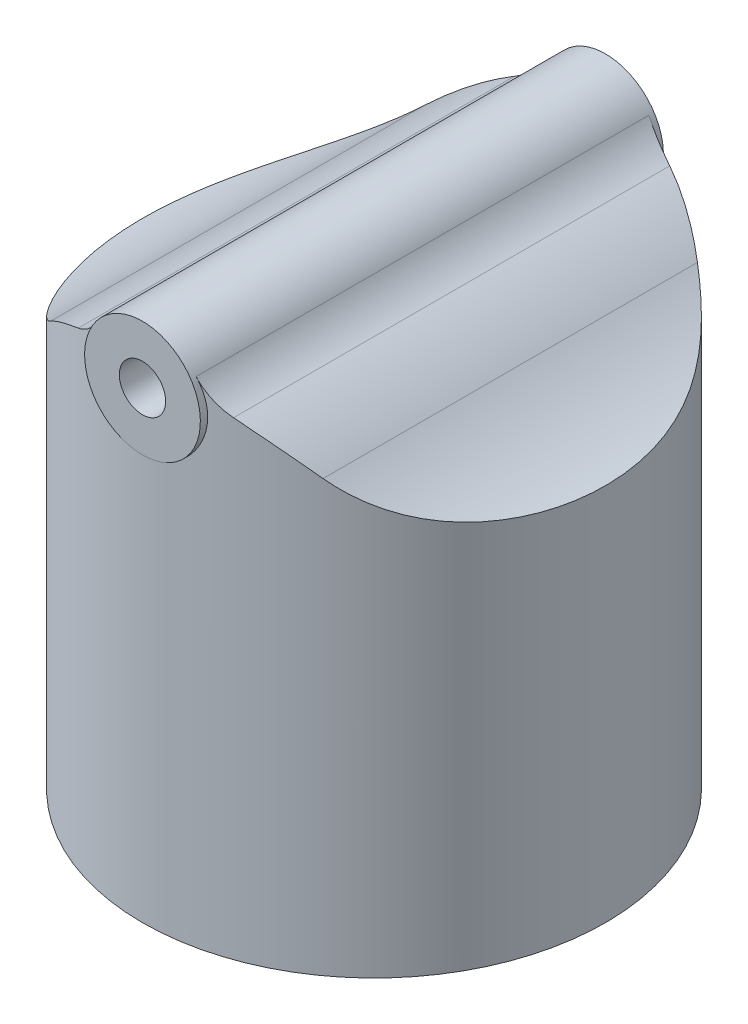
SolidWorks part; units mm, degrees
ref_plane "Front Plane" through (0, 0, 0) normal (0, 0, 1) x (1, 0, 0)
ref_plane "Top Plane" through (0, 0, 0) normal (0, 1, 0) x (1, 0, 0)
ref_plane "Right Plane" through (0, 0, 0) normal (1, 0, 0) x (0, 0, -1)
sketch "Sketch1" plane through (0, 0, 0) normal (0, 1, 0) x (1, 0, 0)
  circle A0 centre (0, 0) radius 500
  dimension "D1" = 1000
extrude "Boss-Extrude1" add sketch "Sketch1" along normal blind 1000
ref_point "Point1"
sketch "Sketch2" plane through (0, 0, 0) normal (0, 0, 1) x (1, 0, 0)
  circle A0 centre (0, 1000) radius 125
  dimension "D1" = 250
extrude "Boss-Extrude2" add sketch "Sketch2" along normal through all and the other way through all
sketch "Sketch3" plane through (0, 0, 500) normal (0, 0, 1) x (1, 0, 0)
  circle A0 centre (0, 1000) radius 50
  dimension "D1" = 100
extrude "Cut-Extrude1" cut sketch "Sketch3" against normal through all both and the other way through all
fillet "Fillet1" radius 150 2 edges at (-125, 1000, 0) (125, 1000, 0)
ref_point "Point2"
sketch "Sketch4" plane through (0, 1000, 0) normal (0, 1, 0) x (1, 0, 0)
  line L1 (-230.4886, -443.706) -> (-230.4886, 443.706)
  line L2 (-230.4886, -443.706) -> (-230.4886, 443.706)
  line L3 (230.4886, 443.706) -> (230.4886, -443.706)
  line L4 (230.4886, 443.706) -> (230.4886, -443.706)
  arc A1 (-230.4886, 443.706) -> (-230.4886, -443.706) centre (0, 0) ccw
  arc A2 (-230.4886, 443.706) -> (-230.4886, -443.706) centre (0, 0) ccw
  arc A3 (230.4886, -443.706) -> (230.4886, 443.706) centre (0, 0) ccw
  arc A4 (230.4886, -443.706) -> (230.4886, 443.706) centre (0, 0) ccw
  dimension "D1" = 0
  dimension "D2" = 0
extrude "Cut-Extrude2" cut sketch "Sketch4" against normal blind 200
fillet "Fillet2" radius 500 2 edges at (230.4886, 800, 0) (-230.4886, 800, 0)
fillet "Fillet3" radius 500 2 edges at (230.4886, 1000, 0) (-230.4886, 1000, 0)
